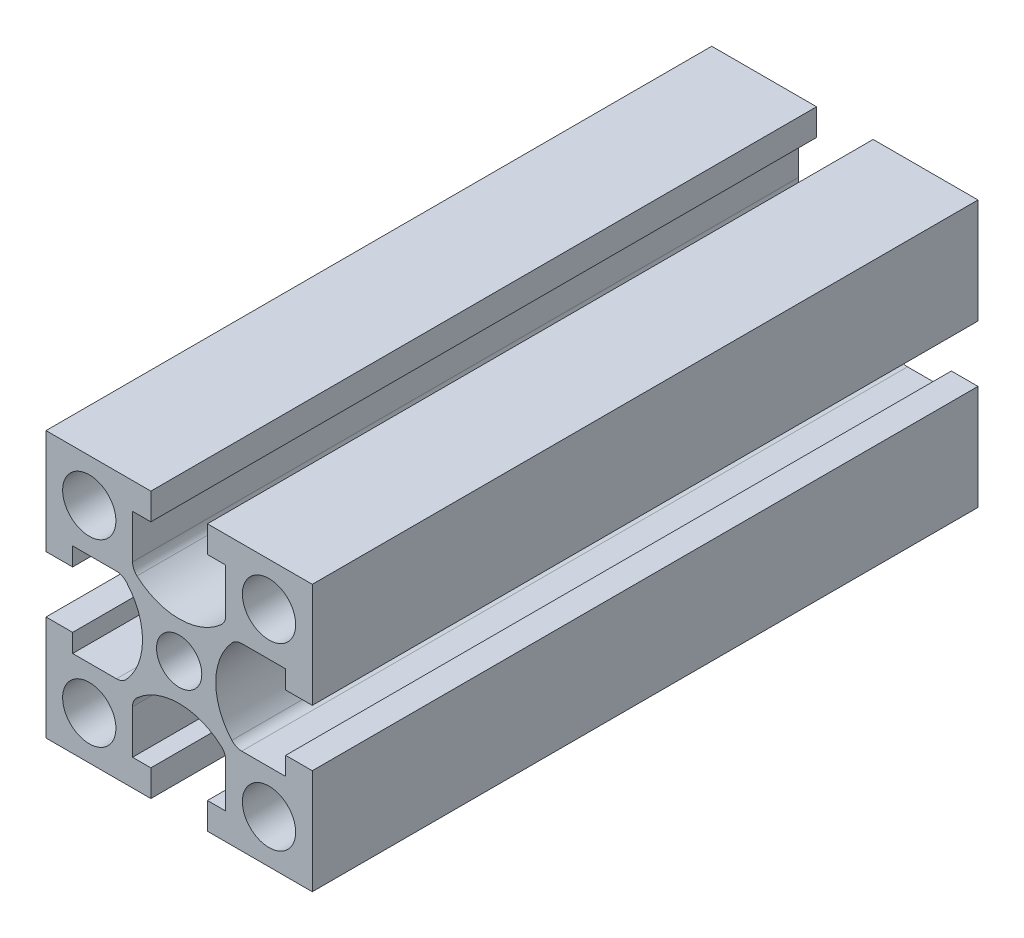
SolidWorks part; units mm, degrees
ref_plane "前基準面" through (0, 0, 0) normal (0, 0, 1) x (1, 0, 0)
ref_plane "上基準面" through (0, 0, 0) normal (0, 1, 0) x (1, 0, 0)
ref_plane "右基準面" through (0, 0, 0) normal (1, 0, 0) x (0, 0, -1)
sketch "草圖1" plane through (0, 0, 0) normal (0, 0, 1) x (1, 0, 0)
  line L0 (0, 53.2301) -> (0, -51.0629) construction
  line L2 (-20, 20) -> (20, 20)
  line L3 (-20, 20) -> (-20, -20)
  line L4 (-20, -20) -> (20, -20)
  line L5 (20, 20) -> (20, -20)
  line L6 (-20, 20) -> (20, -20) construction
  line L7 (-20, -20) -> (20, 20) construction
  point P3 (0, 0)
  dimension "D1" = 40
  dimension "D2" = 40
extrude "填料-伸長1" add sketch "草圖1" along normal mid plane 100
sketch "草圖2" plane through (0, 0, 50) normal (0, 0, 1) x (1, 0, 0)
  circle A0 centre (0, 0) radius 3.4
extrude "除料-伸長1" cut sketch "草圖2" against normal through all
sketch "草圖3" plane through (0, 0, 50) normal (0, 0, 1) x (1, 0, 0)
  circle A0 centre (-13.5, 13.5) radius 4
  circle A1 centre (0, 0) radius 3.4 construction
  dimension "D2" = 8
  dimension "D1" = 13.5
  dimension "D3" = 13.5
extrude "除料-伸長2" cut sketch "草圖3" against normal through all
pattern_circular "環狀複製排列1" count 4 over 360 about axis through (0, 0, 0) along (0, 0, 1) of "除料-伸長2"
sketch "草圖4" plane through (0, 0, 50) normal (0, 0, 1) x (1, 0, 0)
  line L0 (4.25, 20) -> (-4.25, 20)
  line L1 (20, 20) -> (-20, 20) construction
  line L2 (-4.25, 20) -> (-4.25, 16)
  line L3 (-4.25, 16) -> (-7, 16)
  line L4 (-7, 16) -> (-7, 9.4098)
  line L5 (0, 0) -> (0, 20) construction
  line L6 (7, 16) -> (7, 9.4098)
  line L7 (4.25, 16) -> (7, 16)
  line L8 (4.25, 20) -> (4.25, 16)
  arc A0 (-6.3333, 7.9191) -> (6.3333, 7.9191) centre (0, 15) ccw
  arc A1 (7, 9.4098) -> (6.3333, 7.9191) centre (5, 9.4098) cw
  arc A2 (-7, 9.4098) -> (-6.3333, 7.9191) centre (-5, 9.4098) ccw
  point P16 (7, 8.5774)
  point P19 (-7, 8.5774)
  dimension "D1" = 9.5
  dimension "D6" = 2
  dimension "D2" = 4
  dimension "D3" = 1
  dimension "D4" = 14
  dimension "D5" = 8.5
extrude "除料-伸長3" cut sketch "草圖4" against normal through all
pattern_circular "環狀複製排列2" count 4 over 360 about axis through (0, 0, 0) along (0, 0, 1) of "除料-伸長3"
